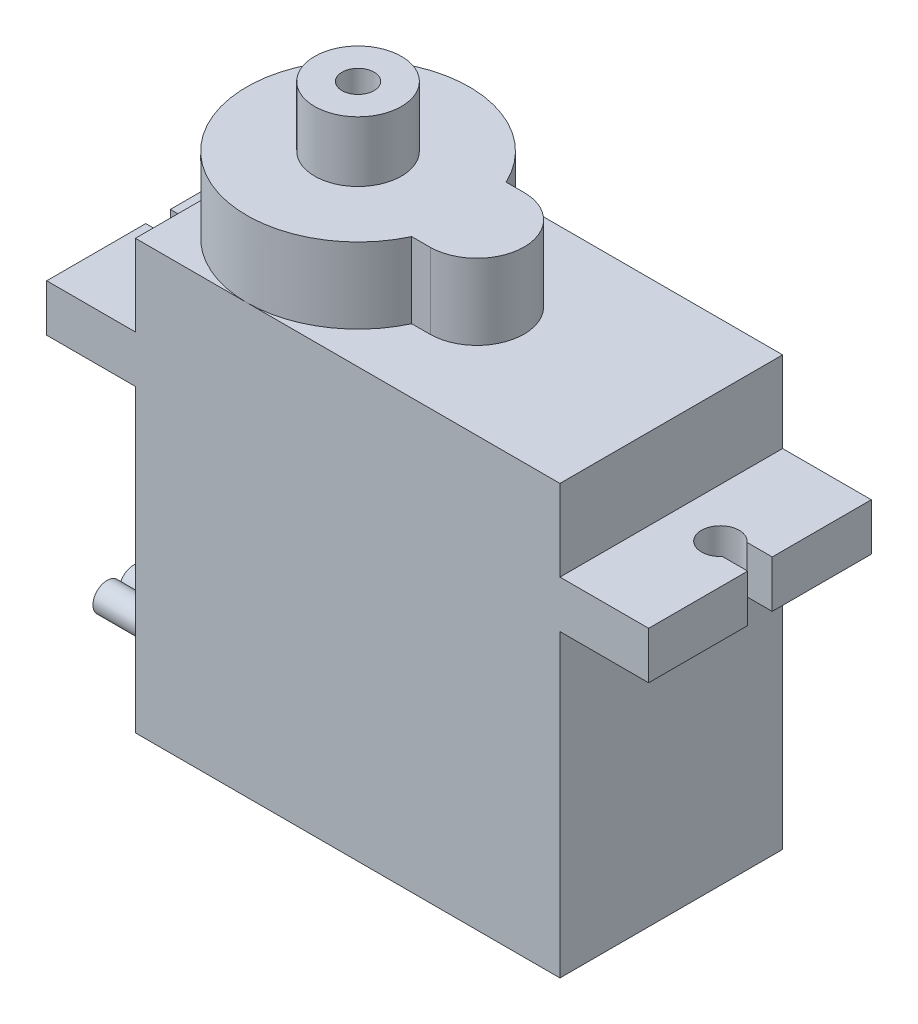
SolidWorks part; units mm, degrees
ref_plane "Plan de face" through (0, 0, 0) normal (0, 0, 1) x (1, 0, 0)
ref_plane "Plan de dessus" through (0, 0, 0) normal (0, 1, 0) x (1, 0, 0)
ref_plane "Plan de droite" through (0, 0, 0) normal (1, 0, 0) x (0, 0, -1)
sketch "Esquisse1" plane through (0, 0, 0) normal (0, 0, 1) x (1, 0, 0)
  line L0 (0, 0) -> (0, 15.9)
  line L1 (0, 15.9) -> (-4.7, 15.9)
  line L2 (-4.7, 15.9) -> (-4.7, 18.4)
  line L3 (-4.7, 18.4) -> (0, 18.4)
  line L4 (0, 18.4) -> (0, 22.7)
  line L5 (0, 22.7) -> (22.5, 22.7)
  line L6 (22.5, 22.7) -> (22.5, 18.4)
  line L7 (22.5, 18.4) -> (27.2, 18.4)
  line L8 (27.2, 18.4) -> (27.2, 15.9)
  line L9 (27.2, 15.9) -> (22.5, 15.9)
  line L10 (22.5, 15.9) -> (22.5, 0)
  line L11 (22.5, 0) -> (0, 0)
  dimension "D1" = 22.5
  dimension "D2" = 15.9
  dimension "D3" = 15.9
  dimension "D4" = 2.5
  dimension "D5" = 2.5
  dimension "D6" = 22.7
  dimension "D7" = 22.5
  dimension "D8" = 4.7
  dimension "D9" = 4.7
extrude "Boss.-Extru.1" add sketch "Esquisse1" along normal mid plane 11.8
sketch "Esquisse2" plane through (0, 22.7, 0) normal (0, 1, 0) x (1, 0, 0)
  line L0 (8.6098, 0) -> (12.2, 0) construction
  line L1 (11.2442, 2.5) -> (12.169, 2.5)
  line L2 (11.2442, -2.5) -> (12.231, -2.5)
  line L3 (22.5, 5.9) -> (0, 5.9) construction
  line L4 (0, -5.9) -> (0, 5.9) construction
  arc A0 (11.2442, 2.5) -> (11.2442, -2.5) centre (5.9, 0) ccw
  arc A2 (12.231, -2.5) -> (12.169, 2.5) centre (12.2, 0) ccw
  point P4 (12.393, 1.054)
  dimension "D1" = 5.9
  dimension "D2" = 5.9
  dimension "D3" = 5.9
  dimension "D4" = 5
  dimension "D5" = 5.9
  dimension "D6" = 6.3
extrude "Boss.-Extru.2" add sketch "Esquisse2" along normal blind 4
sketch "Esquisse3" plane through (0, 26.7, 0) normal (0, 1, 0) x (1, 0, 0)
  circle A0 centre (5.9, 0) radius 2.3
  circle A1 centre (5.9, 0) radius 0.85
  dimension "D1" = 4.6
  dimension "D2" = 1.7
extrude "Boss.-Extru.3" add sketch "Esquisse3" along normal blind 3.2
sketch "Esquisse4" plane through (0, 18.4, 0) normal (0, 1, 0) x (1, 0, 0)
  line L0 (0, 5.9) -> (-4.7, 5.9) construction
  line L1 (-6.6354, 0.65) -> (-3.3599, 0.65)
  line L2 (-6.6354, 0.65) -> (-6.6354, -0.65)
  line L3 (-6.6354, -0.65) -> (-3.3599, -0.65)
  line L5 (25.8599, 0.65) -> (30.6007, 0.65)
  line L7 (25.8599, -0.65) -> (30.6007, -0.65)
  line L8 (30.6007, 0.65) -> (30.6007, -0.65)
  line L9 (27.2, 5.9) -> (22.5, 5.9) construction
  line L10 (-4.7, -5.9) -> (-4.7, 5.9) construction
  line L11 (27.2, -5.9) -> (27.2, 5.9) construction
  arc A0 (-3.3599, -0.65) -> (-3.3599, 0.65) centre (-2.6, 0) ccw
  arc A1 (25.8599, 0.65) -> (25.8599, -0.65) centre (25.1, 0) ccw
  dimension "D3" = 1
  dimension "D4" = 1
  dimension "D1" = 5.9
  dimension "D2" = 5.9
  dimension "D5" = 2.1
  dimension "D6" = 2.1
  dimension "D7" = 1.3
  dimension "D8" = 1.3
  dimension "D9" = 5.25
  dimension "D10" = 5.25
extrude "Enlèv. mat.-Extru.1" cut sketch "Esquisse4" against normal blind 3.2
sketch "Esquisse5" plane through (0, 0, 0) normal (-1, 0, 0) x (0, 0, 1)
  line L0 (5.9, 15.9) -> (5.9, 0) construction
  line L1 (5.9, 0) -> (-5.9, 0) construction
  arc A0 (-0.7, 0.7307) -> (0.7, 0.7307) centre (0, 1) ccw
  arc A1 (0.7, 0.7307) -> (0.7, 1.2693) centre (1.4, 1) ccw
  arc A2 (-0.7, 1.2693) -> (-0.7, 0.7307) centre (-1.4, 1) ccw
  arc A3 (0.7, 1.2693) -> (-0.7, 1.2693) centre (0, 1) ccw
  dimension "D1" = 1.5
  dimension "D2" = 1.5
  dimension "D3" = 1.5
  dimension "D4" = 1.4
  dimension "D5" = 1.4
  dimension "D6" = 5.9
  dimension "D7" = 1
extrude "Boss.-Extru.4" add sketch "Esquisse5" along normal blind 6
